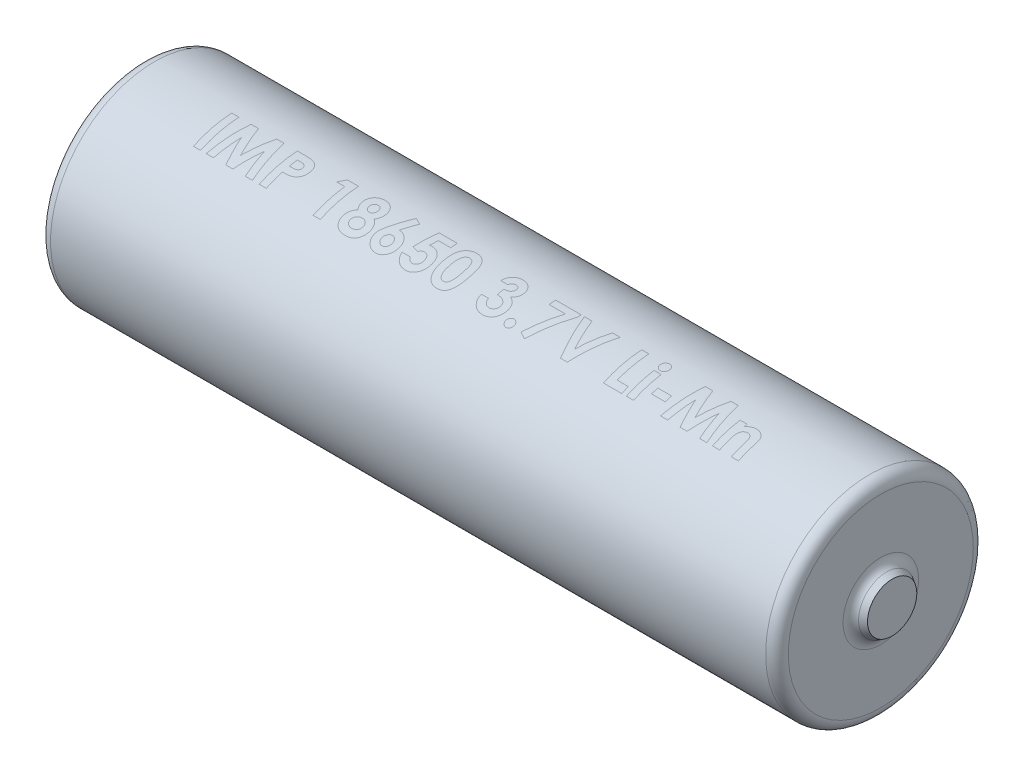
SolidWorks part; units mm, degrees
ref_plane "Plan de face" through (0, 0, 0) normal (0, 0, 1) x (1, 0, 0)
ref_plane "Plan de dessus" through (0, 0, 0) normal (0, 1, 0) x (1, 0, 0)
ref_plane "Plan de droite" through (0, 0, 0) normal (1, 0, 0) x (0, 0, -1)
sketch "Esquisse1" plane through (0, 0, 0) normal (1, 0, 0) x (0, 0, -1)
  circle A0 centre (0, 0) radius 9.15
  dimension "D1" = 18.3
extrude "Boss.-Extru.1" add sketch "Esquisse1" along normal mid plane 65
sketch "Esquisse2" plane through (32.5, 0, 0) normal (1, 0, 0) x (0, 0, -1)
  circle A0 centre (0, 0) radius 2.75
  dimension "D1" = 5.5
extrude "Boss.-Extru.2" add sketch "Esquisse2" along normal blind 1 draft 30
fillet "Congé1" radius 1 3 edges at (32.5, 0, -2.75) (-32.5, 0, -9.15) (32.5, 0, -9.15)
sketch "Esquisse3" plane through (0, 0, 0) normal (0, 1, 0) x (1, 0, 0)
  line L0 (-24.5, -4) -> (25.8183, -4) construction
  line L3 (-32.5, 8.15) -> (-32.5, -8.15) construction
  text T0 "IMP 18650 3.7V Li-Mn" font "Century Gothic" height 3.5
  dimension "D1" = 4
  dimension "D2" = 8
wrap "Enroulement1" sketch "Esquisse3" wrap type scribe source sketch "Esquisse3"
